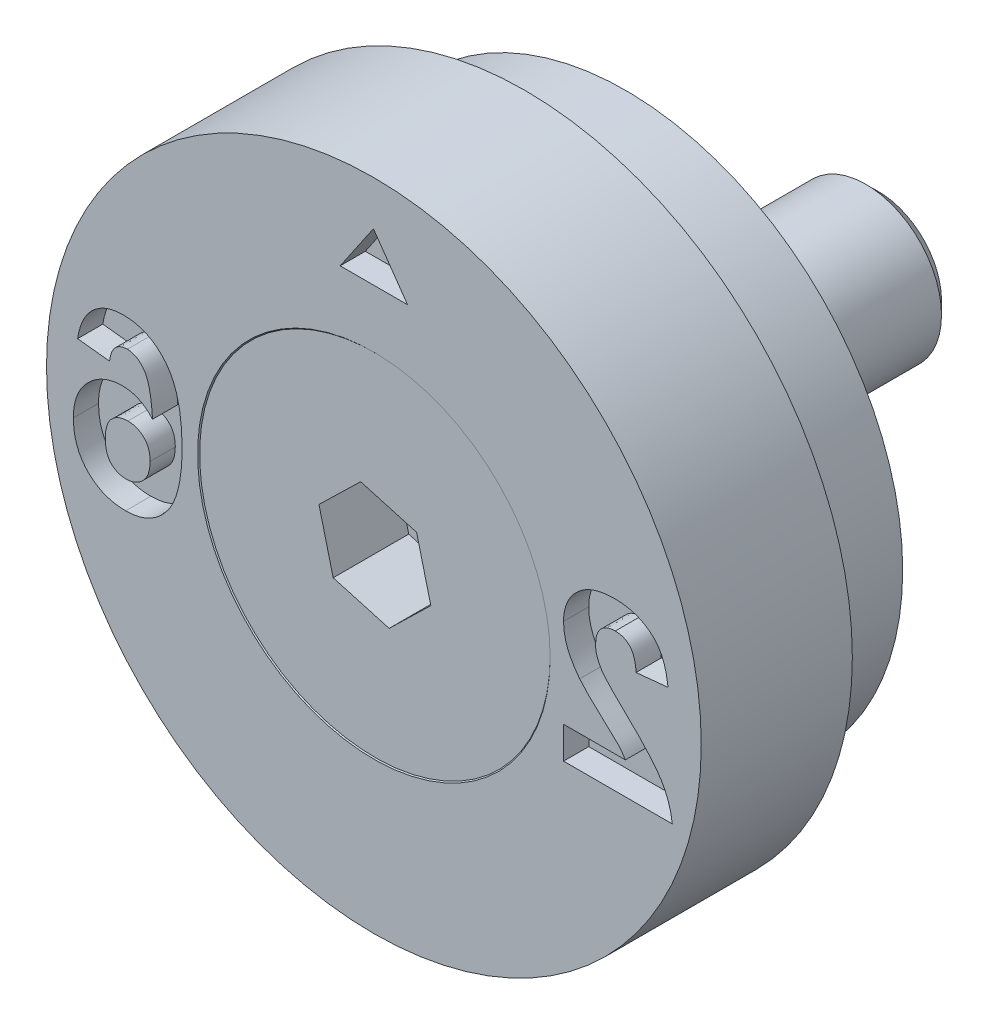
SolidWorks part; units mm, degrees
other "<M3 X .5 FHCS>-<Imported1>"
ref_plane "Front Plane" through (0, 0, 0) normal (0, 0, 1) x (1, 0, 0)
ref_plane "Top Plane" through (0, 0, 0) normal (0, 1, 0) x (1, 0, 0)
ref_plane "Right Plane" through (0, 0, 0) normal (1, 0, 0) x (0, 0, -1)
imported_body "Imported1"
sketch "Sketch1" plane through (0, 0, 0) normal (0, 0, 1) x (1, 0, 0)
  text T0 "2      6" font "Arial" height 3.302
  dimension "D1" = 1.651
extrude "Cut-Extrude1" cut sketch "Sketch1" against normal blind 0.5
inserted part "M3 X .5 FHCS"
move or copy body "Body-Move/Copy2" placed by mates yes
